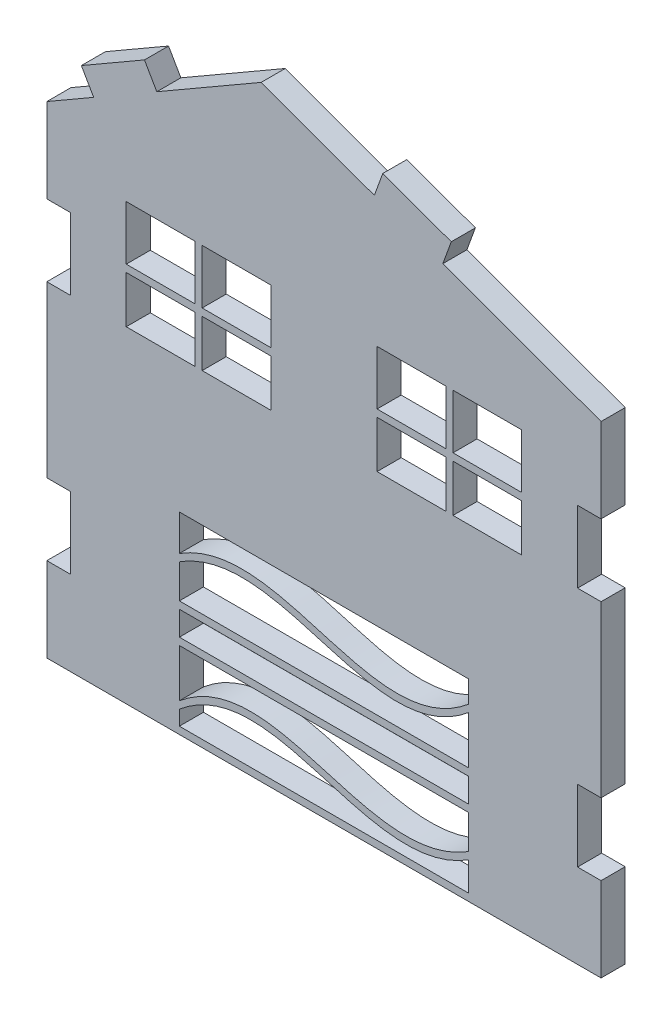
SolidWorks part; units mm, degrees
ref_plane "Front Plane" through (0, 0, 0) normal (0, 0, 1) x (1, 0, 0)
ref_plane "Top Plane" through (0, 0, 0) normal (0, 1, 0) x (1, 0, 0)
ref_plane "Right Plane" through (0, 0, 0) normal (1, 0, 0) x (0, 0, -1)
sketch "Sketch1" plane through (0, 0, 0) normal (0, 0, 1) x (1, 0, 0)
  line L0 (-141.0684, 341.3573) -> (-141.0684, -392.4318) construction
  line L1 (-230, 0) -> (0, 0)
  line L2 (0, 200) -> (0, 175)
  line L3 (-175, 45.0362) -> (-175, 35)
  line L4 (-230, 0) -> (-230, 35)
  line L5 (-230, 200) -> (-210.5583, 211.2247)
  line L6 (-357.5593, 100) -> (119.5747, 100) construction
  line L7 (-115, 10) -> (-115, 200) construction
  line L8 (-94.0838, 234.2437) -> (-90.5815, 243.8661)
  line L9 (-175, 80) -> (-55, 80)
  line L10 (-230, 165) -> (-220.24, 165)
  line L11 (-175, 80) -> (-175, 65.0782)
  line L12 (-220.24, 135.24) -> (-220.24, 165)
  line L13 (-55, 80) -> (-55, 70.9021)
  line L14 (-175, 35) -> (-55, 35)
  line L15 (-175, 32) -> (-55, 32)
  line L16 (-230, 135.24) -> (-220.24, 135.24)
  line L17 (-230, 165) -> (-230, 175)
  line L18 (0, 135.24) -> (-9.76, 135.24)
  line L19 (-230, 175) -> (-230, 200)
  line L20 (0, 35) -> (-9.76, 35)
  line L21 (-210.5583, 211.2247) -> (-215.6783, 220.0928)
  line L22 (-9.76, 64.76) -> (-9.76, 35)
  line L23 (0, 64.76) -> (-9.76, 64.76)
  line L24 (-9.76, 135.24) -> (-9.76, 165)
  line L25 (-230, 64.76) -> (-230, 135.24)
  line L26 (0, 165) -> (-9.76, 165)
  line L27 (0, 135.24) -> (0, 64.76)
  line L28 (-230, 64.76) -> (-220.24, 64.76)
  line L29 (-175, 62.0782) -> (-175, 48.0362)
  line L30 (-230, 35) -> (-220.24, 35)
  line L31 (-220.24, 64.76) -> (-220.24, 35)
  line L32 (-184.3697, 226.3447) -> (-189.4897, 235.2128)
  line L33 (-215.6783, 220.0928) -> (-189.4897, 235.2128)
  line L34 (-230, 0) -> (-202.5, 0) construction
  line L35 (-55, 45.0362) -> (-55, 35)
  line L36 (-55, 67.9021) -> (-55, 48.0362)
  line L38 (-184.3697, 226.3447) -> (-141.0684, 251.3447)
  line L39 (-115, 52.5) -> (-298.996, 52.5) construction
  line L40 (-141.0684, 251.3447) -> (-94.0838, 234.2437)
  line L41 (0, 175) -> (0, 165)
  line L42 (0, 35) -> (0, 0)
  line L43 (-90.5815, 243.8661) -> (-62.1652, 233.5234)
  line L44 (-62.1652, 233.5234) -> (-65.6674, 223.901)
  line L45 (-65.6674, 223.901) -> (0, 200)
  line L46 (-175, 48.0362) -> (-55, 48.0362)
  line L47 (-175, 45.0362) -> (-55, 45.0362)
  line L50 (-55, 14.958) -> (-55, 3)
  line L51 (-175, 9.1341) -> (-175, 3)
  line L52 (-175, 3) -> (-55, 3)
  line L54 (-175, 32) -> (-175, 12.1341)
  line L56 (-55, 32) -> (-55, 17.958)
  line L80 (-167.0516, 180.5276) -> (-167.0516, 135.5276) construction
  line L81 (-197.0516, 180.5276) -> (-168.5516, 180.5276)
  line L82 (-197.0516, 180.5276) -> (-197.0516, 158.0276)
  line L83 (-197.0516, 135.5276) -> (-168.5516, 135.5276)
  line L84 (-137.0516, 180.5276) -> (-137.0516, 158.0276)
  line L85 (-168.5516, 180.5276) -> (-168.5516, 158.0276)
  line L86 (-168.5516, 158.0276) -> (-197.0516, 158.0276)
  line L87 (-197.0516, 155.0276) -> (-168.5516, 155.0276)
  line L88 (-168.5516, 155.0276) -> (-168.5516, 135.5276)
  line L89 (-165.5516, 155.0276) -> (-165.5516, 135.5276)
  line L90 (-165.5516, 180.5276) -> (-165.5516, 158.0276)
  line L91 (-137.0516, 155.0276) -> (-165.5516, 155.0276)
  line L92 (-165.5516, 158.0276) -> (-137.0516, 158.0276)
  line L93 (-197.0516, 155.0276) -> (-197.0516, 135.5276)
  line L94 (-165.5516, 180.5276) -> (-137.0516, 180.5276)
  line L95 (-137.0516, 155.0276) -> (-137.0516, 135.5276)
  line L96 (-165.5516, 135.5276) -> (-137.0516, 135.5276)
  line L97 (-62.9484, 180.5276) -> (-62.9484, 135.5276) construction
  line L98 (-64.4484, 135.5276) -> (-92.9484, 135.5276)
  line L99 (-92.9484, 155.0276) -> (-92.9484, 135.5276)
  line L100 (-64.4484, 180.5276) -> (-92.9484, 180.5276)
  line L101 (-32.9484, 155.0276) -> (-32.9484, 135.5276)
  line L102 (-64.4484, 158.0276) -> (-92.9484, 158.0276)
  line L103 (-92.9484, 155.0276) -> (-64.4484, 155.0276)
  line L104 (-64.4484, 180.5276) -> (-64.4484, 158.0276)
  line L105 (-64.4484, 155.0276) -> (-64.4484, 135.5276)
  line L106 (-61.4484, 155.0276) -> (-61.4484, 135.5276)
  line L107 (-32.9484, 155.0276) -> (-61.4484, 155.0276)
  line L108 (-61.4484, 158.0276) -> (-32.9484, 158.0276)
  line L109 (-61.4484, 180.5276) -> (-61.4484, 158.0276)
  line L110 (-92.9484, 180.5276) -> (-92.9484, 158.0276)
  line L111 (-32.9484, 135.5276) -> (-61.4484, 135.5276)
  line L112 (-32.9484, 180.5276) -> (-32.9484, 158.0276)
  line L113 (-32.9484, 180.5276) -> (-61.4484, 180.5276)
  spline S0 degree 3 poles (-175, 65.0782) (-134.0615, 90.8447) (-93.7551, 38.5281) (-55, 70.9021) knots 0 0 0 0 1 1 1 1
  spline S1 degree 3 poles (-175, 62.0782) (-134.0615, 87.8447) (-93.7551, 35.5281) (-55, 67.9021) knots 0 0 0 0 1 1 1 1
  spline S2 degree 3 poles (-175, 17.958) (-134.0615, -7.8084) (-93.7551, 44.5081) (-55, 12.1341) knots 0 0 0 0 1 1 1 1 construction
  spline S3 degree 3 poles (-175, 14.958) (-134.0615, -10.8084) (-93.7551, 41.5081) (-55, 9.1341) knots 0 0 0 0 1 1 1 1 construction
  spline S4 degree 3 poles (-55, 14.958) (-95.9385, -10.8084) (-136.2449, 41.5081) (-175, 9.1341) knots 0 0 0 0 1 1 1 1
  spline S5 degree 3 poles (-55, 17.958) (-95.9385, -7.8084) (-136.2449, 44.5081) (-175, 12.1341) knots 0 0 0 0 1 1 1 1
  point P13 (-115, 80)
extrude "Boss-Extrude1" add sketch "Sketch1" along normal blind 10
equation "\"HeightHouse\" = \"SCALE\"*200mm"
equation "\"LenghtHouse\"=\"SCALE\"* 300mm"
equation "\"WidthHouse\"= \"SCALE\"*230mm"
equation "\"ThicknessMaterial\"=10mm"
equation "\"Kerf\"= 0.12mm"
equation "\"WidthWindows\"=\"SCALE\"* 45mm"
equation "\"WidthDoor\"=\"SCALE\"* 60mm"
equation "\"HeightDoor\"=\"SCALE\"* 80mm"
equation "\"D2@Sketch1\"=\"ThicknessMaterial\"-\"Kerf\"*2"
equation "\"LenghtJoints\" =\"SCALE\"* 30mm"
equation "\"D3@Sketch1\"=\"LenghtJoints\"-\"Kerf\"*2"
equation "\"D9@Sketch1\"=\"LenghtJoints\"+\"Kerf\"*2"
equation "\"D12@Sketch1\"=\"ThicknessMaterial\"+\"Kerf\"*2"
equation "\"D13@Sketch1\"=\"WidthHouse\""
equation "\"D10@Sketch1\"=\"HeightHouse\""
equation "\"HeightWindows\"=\"SCALE\"* 60"
equation "\"D4@Sketch1\"=\"DistanceForJointsBody\""
equation "\"Roof1\"=\"SCALE\"* 115mm"
equation "\"Roof2\"=\"SCALE\"* 140mm"
equation "\"D1@Boss-Extrude1\"=\"ThicknessMaterial\""
equation "\"WidthWindowFrame\"=\"SCALE\"* 3mm"
equation "\"D19@Sketch1\"=\"WidthWindows\""
equation "\"D20@Sketch1\"=\"HeightWindows\""
equation "\"D21@Sketch1\"=\"WidthWindowFrame\"/2"
equation "\"D22@Sketch1\"=\"WidthWindowFrame\""
equation "\"D23@Sketch1\"=\"WidthWindowFrame\"/2"
equation "\"D14@Sketch1\"=\"WidthDoor\"*2"
equation "\"D25@Sketch1\"=\"WidthWindowFrame\""
equation "\"DistanceForJointsRoof\"=\"SCALE\"* 50mm"
equation "\"DistanceForJointsBody\"=\"SCALE\"* 35mm"
equation "\"CornerRoofBig\"=70deg"
equation "\"CornerRoofSmall\"= 60deg"
equation "\"D6@Sketch1\"=\"CornerRoofBig\""
equation "\"D11@Sketch1\"=\"HeightHouse\"/2"
equation "\"D5@Sketch1\"=\"DistanceForJointsRoof\""
equation "\"D8@Sketch1\"=\"DistanceForJointsRoof\""
equation "\"LenghtRoof\"= \"LenghtHouse\"+(\"SCALE\"*40mm)"
equation "\"RoofSmall\"=\"SCALE\"* 120mm"
equation "\"RoofBig\"=\"SCALE\"* 170mm"
equation "\"TerraceLenght\"=\"SCALE\"* \"WidthWindows\"+35mm"
equation "\"TerraceHeight\"=\"SCALE\"* \"HeightWindows\"/2"
equation "\"LenghtJointTerrace\"=\"SCALE\"* 10mm"
equation "\"DistanceJointForChimney\"= \"SCALE\"* 10mm"
equation "\"HeightChimney\"= \"SCALE\"* 35mm"
equation "\"WidthChimney\"=\"SCALE\"* 20mm"
